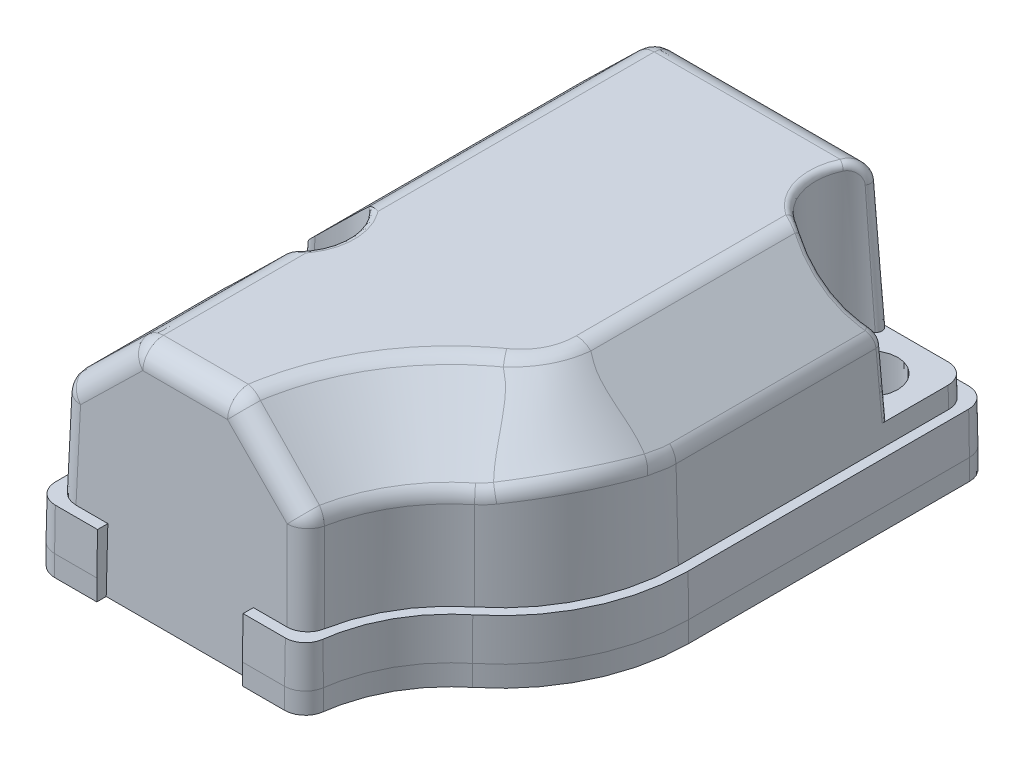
SolidWorks part; units mm, degrees
ref_plane "Front Plane" through (0, 0, 0) normal (0, 0, 1) x (1, 0, 0)
ref_plane "Top Plane" through (0, 0, 0) normal (0, 1, 0) x (1, 0, 0)
ref_plane "Right Plane" through (0, 0, 0) normal (1, 0, 0) x (0, 0, -1)
imported_body "Imported3"
ref_plane "Plane1" through (-6.4687, 0, 0) normal (-1, 0, 0) x (0, -1, 0)
sketch "Sketch1" plane through (-6.4687, 0, 0) normal (-1, 0, 0) x (0, -1, 0)
  line L0 (0, 11.97) -> (0, 12.5)
  line L1 (0, 12.5) -> (-2, 12.4651)
  line L2 (-2, 12.4651) -> (-2, 11.97)
  line L3 (-2, 11.97) -> (0, 11.97)
extrude "Cut-Extrude1" cut sketch "Sketch1" against normal blind 7
sketch "Sketch2" plane through (0, 0, 0) normal (0, -1, 0) x (1, 0, 0)
  line L0 (0.5313, 11.97) -> (0.5313, 12.5)
  line L1 (0.5313, 12.5) -> (3.5, 12.5)
  line L2 (9.5, 0) -> (9.5, -14.5)
  line L3 (9.5, -14.5) -> (-9.5, -14.5)
  line L4 (-9.5, -14.5) -> (-9.5, 12.5)
  line L5 (-9.5, 12.5) -> (-6.4687, 12.5)
  line L6 (-6.4687, 12.5) -> (-6.4687, 11.97)
  line L7 (-6.4687, 11.97) -> (0.5313, 11.97)
  arc A0 (3.5, 12.5) -> (6.1294, 7.0221) centre (10.5208, 12.5) ccw
  arc A1 (6.1294, 7.0221) -> (9.5, 0) centre (0.5, 0) cw
extrude "Boss-Extrude1" add sketch "Sketch2" along normal blind 1
draft "Draft1" type of draft neutral plane draft angle 1.5 faces to draft 6 parameters "D1"=1.5
ref_plane "Plane2" through (0, 0, -11.6) normal (0, 0, 1) x (1, 0, 0)
sketch "Sketch3" plane through (0, 0, -11.6) normal (0, 0, 1) x (1, 0, 0)
  line L0 (9.2095, 10) -> (6.6, 10)
  line L1 (6.6, 10) -> (6.6, -1)
  line L2 (6.6, -1) -> (7.95, -1)
  line L3 (7.95, -1) -> (7.95, 3)
  line L4 (7.95, 3) -> (9.0262, 3)
  line L5 (9.0262, 3) -> (9.2095, 10)
  line L6 (6.6, 10) -> (6.6, -1) construction
revolve "Cut-Revolve1" cut sketch "Sketch3" angle 360 about L6
ref_plane "Plane3" through (0, 0, 2.2) normal (0, 0, 1) x (1, 0, 0)
sketch "Sketch4" plane through (0, 0, 2.2) normal (0, 0, 1) x (1, 0, 0)
  line L0 (-4.6778, 10) -> (-7.2, 10)
  line L1 (-7.2, 10) -> (-7.2, -1)
  line L2 (-7.2, -1) -> (-5.85, -1)
  line L3 (-5.85, -1) -> (-5.85, 3)
  line L4 (-5.85, 3) -> (-4.8, 3)
  line L5 (-4.8, 3) -> (-4.6778, 10)
  line L6 (-7.2, 10) -> (-7.2, -1) construction
revolve "Cut-Revolve2" cut sketch "Sketch4" angle 360 about L6
fillet "VarFillet1" radius 8.3798 1 edges
fillet "Fillet1" radius 1 22 edges at (3.7793, 6.5916, 8.9031) (8.8798, 6.5916, -5.2628) (-8.8798, 6.5916, 7.9253) (-8.8798, 6.5916, -6.7403) (-5.381, 10, -6.6688) (-5.381, 10, 7.8538) (-8.9399, 4.2958, -13.9399) (-8.9399, 4.2958, 11.9099) (-2.9878, 10, 11.7605) (-7.1193, 8.3065, 4.6913) (-7.1304, 8.2958, 11.8051) (-7.1193, 8.3065, -0.2913) (-7.1304, 8.2958, -13.8351) (-0.0995, 10, -13.7905)
fillet "VarFillet2" radius 0.9738 1 edges at (8.9869, 2.5, -13.9869)
fillet "Fillet2" radius 0.3 10 edges at (5.0733, 9.4698, -13.6991) (8.9435, 4.1593, -10.8632) (4.0461, 10, -11.0645) (8.865, 6.3847, -10.5072) (5.296, 9.9469, -9.3413) (7.2725, 8.1574, -9.1286) (-8.9331, 4.5541, 0.5008) (-4.6778, 10, 2.2) (-8.9331, 4.5541, 3.8992)
fillet "VarFillet3" radius 1 2 edges at (-9.4825, 1, -14.4825) (-9.5, -0.5, -14.5)
fillet "VarFillet4" radius 1 2 edges at (3.5, -0.5, 12.5)
fillet "VarFillet5" radius 1 2 edges at (-9.4825, 1, 12.4825) (-9.5, -0.5, 12.5)
fillet "VarFillet6" radius 1 2 edges at (9.4825, 1, -14.4825) (9.5, -0.5, -14.5)
